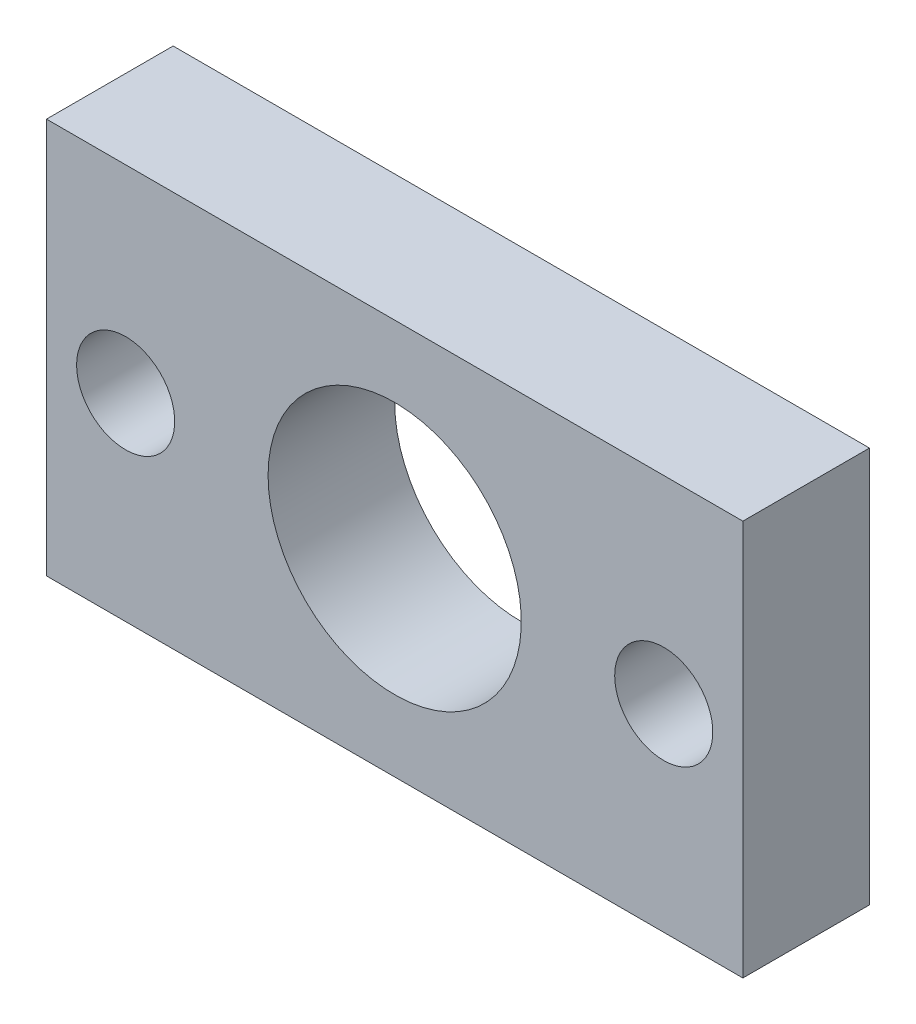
SolidWorks part; units mm, degrees
ref_plane "Plan de face" through (0, 0, 0) normal (0, 0, 1) x (1, 0, 0)
ref_plane "Plan de dessus" through (0, 0, 0) normal (0, 1, 0) x (1, 0, 0)
ref_plane "Plan de droite" through (0, 0, 0) normal (1, 0, 0) x (0, 0, -1)
ref_plane "Plan1" through (0, 0, 4) normal (0, 0, 1) x (1, 0, 0)
sketch "Esquisse1" plane through (0, 0, 4) normal (0, 0, 1) x (1, 0, 0)
  line L0 (-22, 12.5) -> (-22, -12.5)
  line L1 (-22, -12.5) -> (22, -12.5)
  line L2 (22, -12.5) -> (22, 12.5)
  line L3 (22, 12.5) -> (-22, 12.5)
  circle A0 centre (0, 0) radius 8
  circle A1 centre (-17, 0) radius 3.1
  circle A2 centre (17, 0) radius 3.1
extrude "Boss.-Extru.1" add sketch "Esquisse1" against normal blind 8
